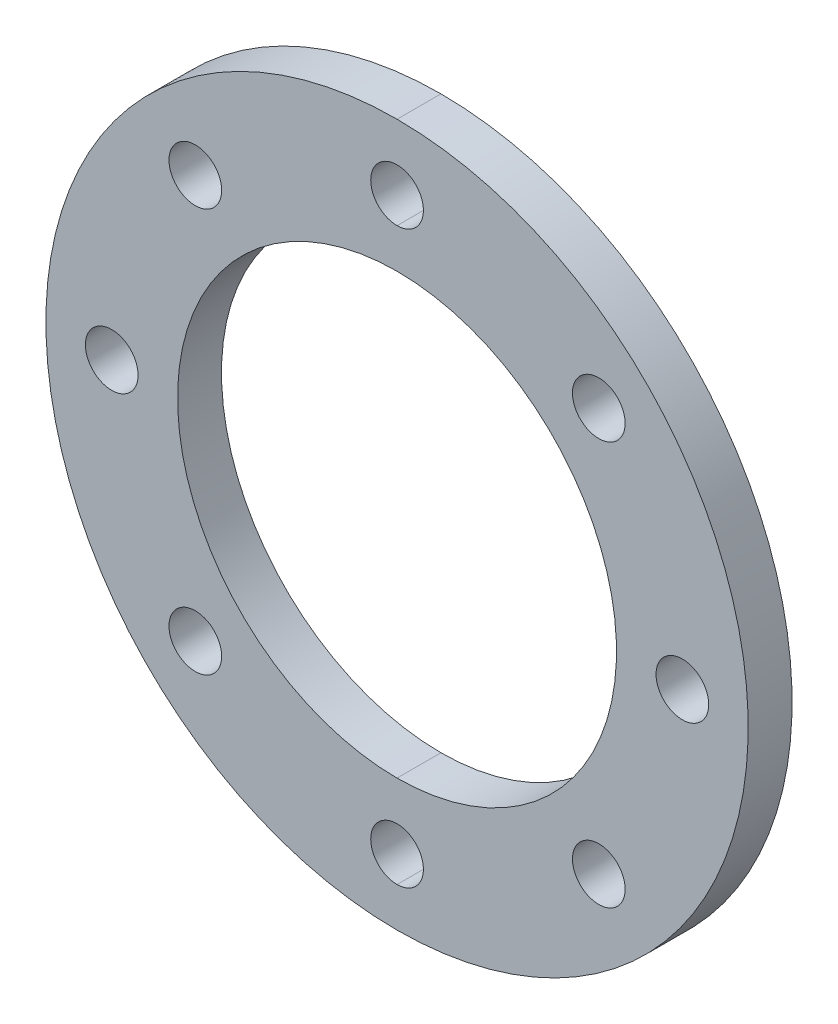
SolidWorks part; units mm, degrees
ref_plane "Front Plane" through (0, 0, 0) normal (0, 0, 1) x (1, 0, 0)
ref_plane "Top Plane" through (0, 0, 0) normal (0, 1, 0) x (1, 0, 0)
ref_plane "Right Plane" through (0, 0, 0) normal (1, 0, 0) x (0, 0, -1)
sketch "Sketch1" plane through (0, 0, 0) normal (0, 0, 1) x (1, 0, 0)
  circle A0 centre (0, 0) radius 40
  dimension "D1" = 80
extrude "Extrude1" add sketch "Sketch1" along normal blind 5
sketch "Sketch2" plane through (0, 0, 5) normal (0, 0, 1) x (1, 0, 0)
  circle A0 centre (0, 0) radius 25
  dimension "D1" = 50
extrude "Extrude2" cut sketch "Sketch2" against normal through all
sketch "Sketch3" plane through (0, 0, 5) normal (0, 0, 1) x (1, 0, 0)
  line L0 (0, 0) -> (60.084, 0) construction
  circle A0 centre (0, 0) radius 32.5 construction
  circle A1 centre (32.5, 0) radius 3
  dimension "D1" = 65
  dimension "D2" = 6
extrude "Extrude3" cut sketch "Sketch3" against normal through all
pattern_circular "CirPattern1" count 8 over 360 about axis through (0, 0, 0) along (0, 0, 1) of "Extrude3"
sketch "Sketch4" plane through (0, 0, 5) normal (0, 0, 1) x (1, 0, 0)
  line L0 (0, 40) -> (0, -40)
  circle A0 centre (0, 0) radius 40 construction
  circle A1 centre (0, 0) radius 25 construction
  circle A2 centre (0, 0) radius 25 construction
ref_plane "Target plane" through (0, -70, 0) normal (0, 1, 0) x (-1, 0, 0)
